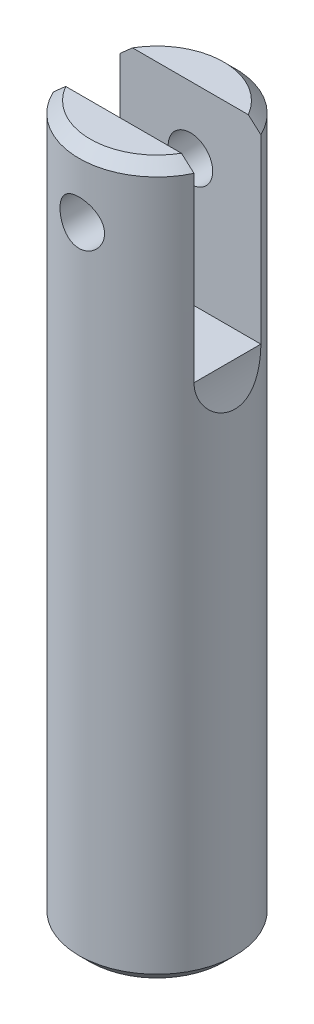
SolidWorks part; units mm, degrees
ref_plane "Front Plane" through (0, 0, 0) normal (0, 0, 1) x (1, 0, 0)
ref_plane "Top Plane" through (0, 0, 0) normal (0, 1, 0) x (1, 0, 0)
ref_plane "Right Plane" through (0, 0, 0) normal (1, 0, 0) x (0, 0, -1)
sketch "Sketch1" plane through (0, 0, 0) normal (0, 1, 0) x (1, 0, 0)
  circle A0 centre (0, 0) radius 5.5562
  dimension "D1" = 11.1125
extrude "Boss-Extrude1" add sketch "Sketch1" along normal blind 50.8
chamfer "Chamfer1" distance 0.7937 angle 45 2 edges at (0, 0, 5.5562) (0, 50.8, 5.5562)
sketch "Sketch2" plane through (0, 50.8, 0) normal (0, 1, 0) x (1, 0, 0)
  line L1 (-9.9509, -2.3813) -> (9.9509, -2.3813)
  line L2 (-9.9509, -2.3813) -> (-9.9509, 2.3813)
  line L3 (-9.9509, 2.3813) -> (9.9509, 2.3813)
  line L4 (9.9509, -2.3813) -> (9.9509, 2.3813)
  line L5 (-9.9509, -2.3813) -> (9.9509, 2.3813) construction
  line L6 (-9.9509, 2.3813) -> (9.9509, -2.3813) construction
  point P0 (0, 0)
  dimension "D1" = 4.7625
extrude "Cut-Extrude1" cut sketch "Sketch2" against normal blind 13.716
sketch "Sketch3" plane through (0, 0, 0) normal (0, 0, 1) x (1, 0, 0)
  line L0 (5.0201, 37.084) -> (5.0201, 50.0063) construction
  line L1 (5.0201, 37.084) -> (5.0201, 56.6089)
  line L2 (-5.0201, 50.0063) -> (-5.0201, 37.084) construction
  line L3 (-5.0201, 56.6089) -> (-5.0201, 37.084)
  line L4 (0, 0) -> (0, 67.1681) construction
  line L5 (-5.0201, 56.6089) -> (5.0201, 56.6089)
  arc A0 (5.0201, 37.084) -> (11.5309, 30.736) centre (11.3701, 37.084) ccw
  arc A1 (-5.0201, 37.084) -> (-10.8789, 30.753) centre (-11.3701, 37.084) cw
  dimension "D1" = 6.35
extrude "Cut-Extrude2" cut sketch "Sketch3" against normal through all and the other way through all flip side to cut
sketch "Sketch4" plane through (0, 0, 0) normal (0, 0, 1) x (1, 0, 0)
  line L0 (0, 0) -> (0, 76.1481) construction
  line L1 (-4.7625, 0) -> (4.7625, 0) construction
  circle A0 centre (0, 46.0375) radius 1.5875
  dimension "D1" = 3.175
  dimension "D2" = 46.0375
extrude "Cut-Extrude3" cut sketch "Sketch4" against normal through all and the other way through all
